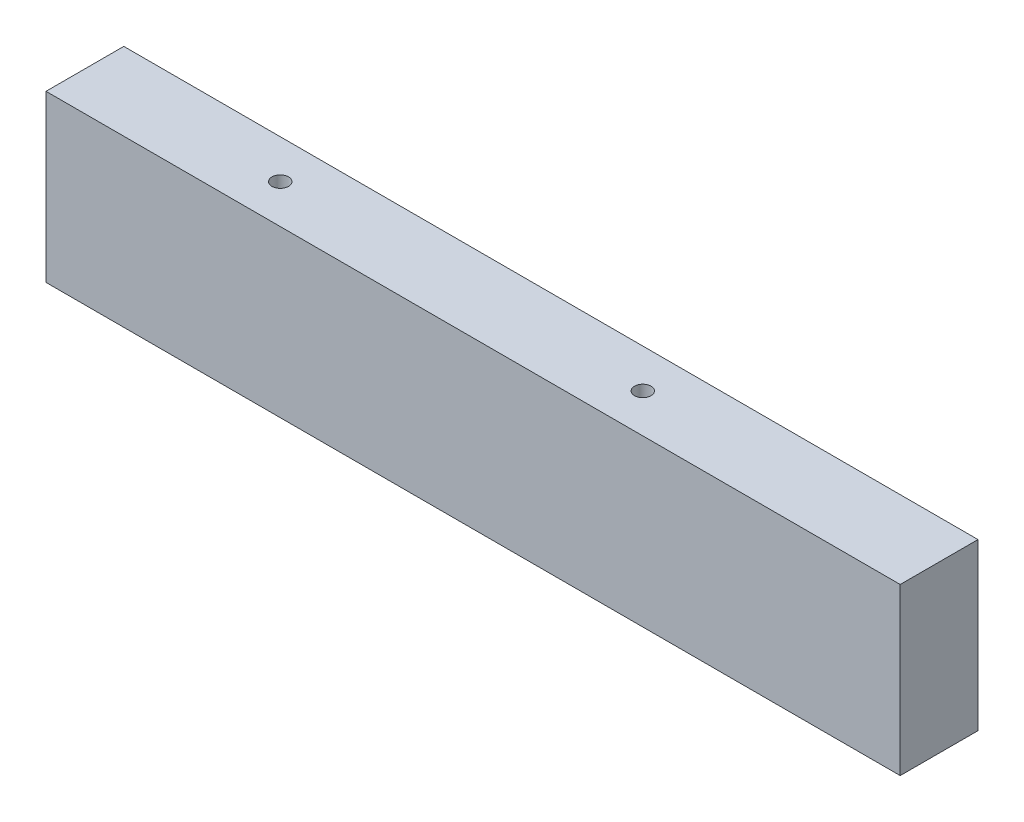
SolidWorks part; units mm, degrees
ref_plane "Front Plane" through (0, 0, 0) normal (0, 0, 1) x (1, 0, 0)
ref_plane "Top Plane" through (0, 0, 0) normal (0, 1, 0) x (1, 0, 0)
ref_plane "Right Plane" through (0, 0, 0) normal (1, 0, 0) x (0, 0, -1)
sketch "Sketch1" plane through (0, 0, 0) normal (0, 1, 0) x (1, 0, 0)
  line L1 (0, 0) -> (516, 0)
  line L2 (0, 0) -> (0, 47)
  line L3 (0, 47) -> (516, 47)
  line L4 (516, 0) -> (516, 47)
  dimension "D1" = 47
  dimension "D2" = 516
extrude "Boss-Extrude1" add sketch "Sketch1" along normal blind 100
ref_plane "Plane1" through (0, 0, -23.5) normal (0, 0, 1) x (1, 0, 0)
sketch "Sketch2" plane through (0, 100, 0) normal (0, 1, 0) x (1, 0, 0)
  circle A4 centre (337, 23.5) radius 5 construction
  circle A5 centre (118, 23.5) radius 5 construction
  circle A6 centre (337, 23.5) radius 5
  circle A7 centre (118, 23.5) radius 5
extrude "Cut-Extrude1" cut sketch "Sketch2" against normal up to next
